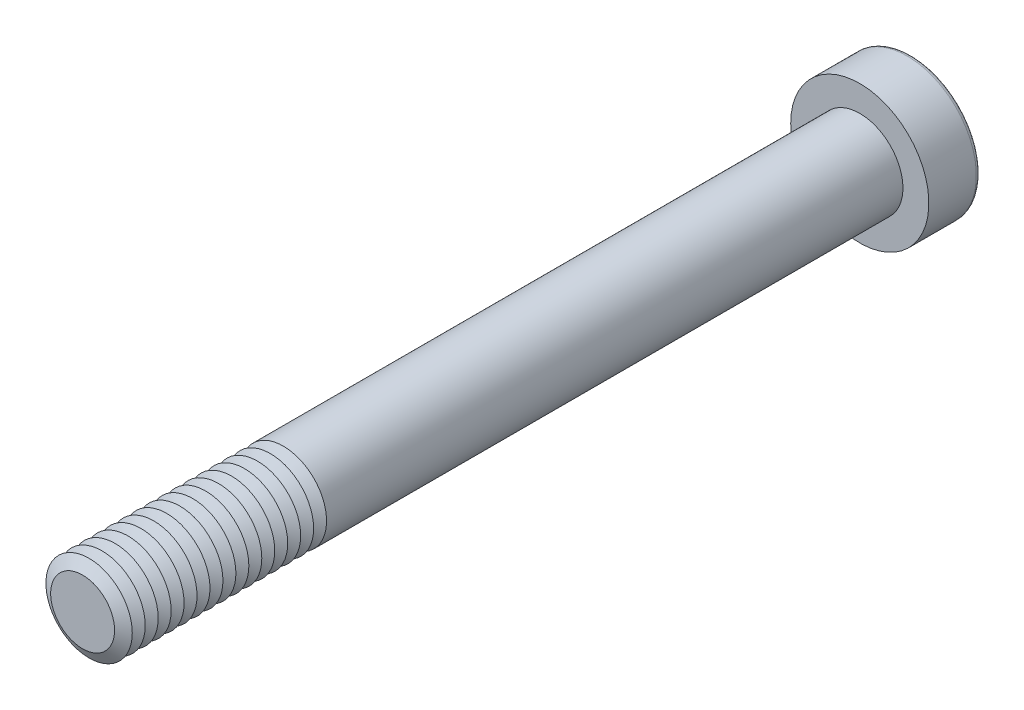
SolidWorks part; units mm, degrees
ref_plane "Front Plane" through (0, 0, 0) normal (0, 0, 1) x (1, 0, 0)
ref_plane "Top Plane" through (0, 0, 0) normal (0, 1, 0) x (1, 0, 0)
ref_plane "Right Plane" through (0, 0, 0) normal (1, 0, 0) x (0, 0, -1)
sketch "Sketch1" plane through (0, 0, 0) normal (0, 0, 1) x (1, 0, 0)
  circle A0 centre (0, 0) radius 5
  dimension "D1" = 10
extrude "Boss-Extrude1" add sketch "Sketch1" along normal blind 90
sketch "Sketch2" plane through (0, 0, 0) normal (0, 0, -1) x (-1, 0, 0)
  circle A0 centre (0, 0) radius 8
  dimension "D1" = 16
extrude "Boss-Extrude2" add sketch "Sketch2" along normal blind 6
sketch "Sketch3" plane through (0, 0, -6) normal (0, 0, -1) x (-1, 0, 0)
  line L1 (-2.0207, 3.5) -> (-4.0415, 0)
  line L2 (-4.0415, 0) -> (-2.0207, -3.5)
  line L3 (-2.0207, -3.5) -> (2.0207, -3.5)
  line L4 (2.0207, -3.5) -> (4.0415, 0)
  line L5 (4.0415, 0) -> (2.0207, 3.5)
  line L6 (2.0207, 3.5) -> (-2.0207, 3.5)
  circle A0 centre (0, 0) radius 3.5 construction
  dimension "D1" = 7
extrude "Cut-Extrude1" cut sketch "Sketch3" against normal blind 5.25
fillet "Fillet1" radius 0.5 1 edges at (-8, 0, -6)
sketch "Sketch4" plane through (0, 0, -0.75) normal (0, 0, -1) x (-1, 0, 0)
  line L0 (2.0207, -3.5) -> (4.0415, 0) construction
  circle A0 centre (0, 0) radius 3.5
extrude "Cut-Extrude2" cut sketch "Sketch4" against normal through all draft 60
sketch "Sketch5" plane through (0, 0, -6) normal (0, 0, -1) x (-1, 0, 0)
  circle A0 centre (0, 0) radius 4.0415
extrude "Cut-Extrude3" cut sketch "Sketch5" against normal through all draft 75
sketch "Sketch7" plane through (0, 0, 0) normal (1, 0, 0) x (0, 0, -1)
  line L25 (-90, 3.701) -> (-89.25, 5)
  line L26 (-90, 5) -> (-90, -5) construction
  line L27 (-89.25, 5) -> (-90.75, 5)
  line L28 (-90.75, 5) -> (-90, 3.701)
  line L29 (0, 5) -> (-90, 5) construction
  dimension "D1" = 1.5
revolve "Cut-Revolve1" cut sketch "Sketch7" angle 360 about axis through (0, 0, 90) along (0, 0, -1)
pattern_linear "LPattern1" count 16 spacing 1.5 along (0, 0, -1) of "Cut-Revolve1"
